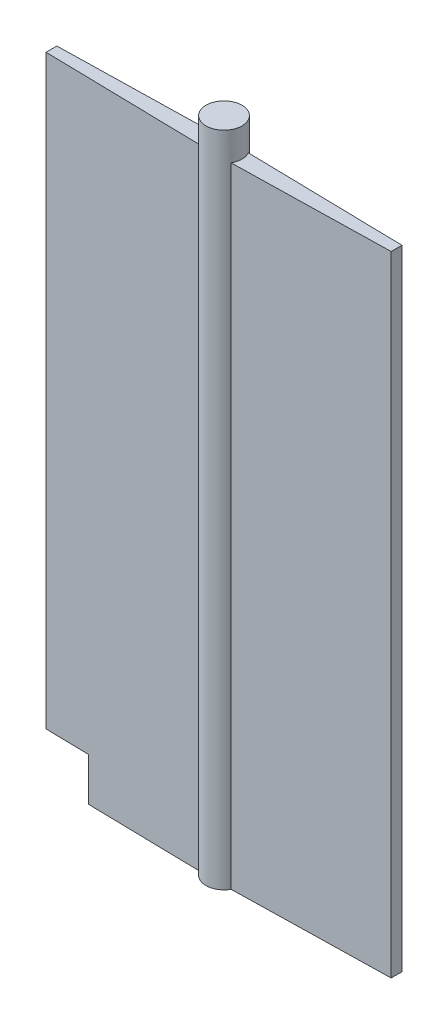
SolidWorks part; units mm, degrees
ref_plane "Front Plane" through (0, 0, 0) normal (0, 0, 1) x (1, 0, 0)
ref_plane "Top Plane" through (0, 0, 0) normal (0, 1, 0) x (1, 0, 0)
ref_plane "Right Plane" through (0, 0, 0) normal (1, 0, 0) x (0, 0, -1)
sketch "Sketch1" plane through (0, 0, 0) normal (0, 1, 0) x (1, 0, 0)
  line L0 (0, 3.175) -> (0, -3.175)
  line L3 (0, 3.175) -> (60.96, 1.905)
  line L4 (60.96, 1.905) -> (60.96, -1.905)
  line L5 (60.96, -1.905) -> (0, -3.175)
  line L6 (-60.96, -1.905) -> (0, -3.175)
  line L7 (-60.96, 1.905) -> (-60.96, -1.905)
  line L8 (0, 3.175) -> (-60.96, 1.905)
  circle A0 centre (0, 0) radius 6.35
  point P5 (60.96, 0)
  point P6 (0, 0)
  dimension "D1" = 12.7
  dimension "D2" = 6.35
  dimension "D3" = 3.81
  dimension "D4" = 60.96
extrude "Boss-Extrude1" add sketch "Sketch1" along normal blind 222.25 contours A0 L5 L4 L3 | A0 L8 L7 L6
sketch "Sketch2" plane through (0, 222.25, 0) normal (0, 1, 0) x (1, 0, 0)
  circle A0 centre (0, 0) radius 6.35
extrude "Boss-Extrude2" add sketch "Sketch2" along normal blind 10.16
sketch "Sketch3" plane through (0, 0, 0) normal (0, 0, 1) x (1, 0, 0)
  line L1 (-60.96, 0) -> (-45.72, 0)
  line L2 (-60.96, 0) -> (-60.96, 15.24)
  line L3 (-60.96, 15.24) -> (-45.72, 15.24)
  line L4 (-45.72, 0) -> (-45.72, 15.24)
  dimension "D1" = 15.24
  dimension "D2" = 15.24
extrude "Cut-Extrude1" cut sketch "Sketch3" against normal through all both and the other way through all
ref_plane "Plane1" through (0, 226.06, 0) normal (0, 1, 0) x (1, 0, 0)
sketch "Sketch4" plane through (0, 226.06, 0) normal (0, 1, 0) x (1, 0, 0)
  line L0 (5.3882, 5.3882) -> (-20.0118, 30.7882)
  line L2 (-30.7882, 20.0118) -> (-5.3882, -5.3882)
  arc A1 (-5.3882, -5.3882) -> (5.3882, 5.3882) centre (0, 0) ccw
  arc A2 (-20.0118, 30.7882) -> (-30.7882, 20.0118) centre (-25.4, 25.4) ccw
  circle A4 centre (0, 0) radius 6.35 construction
  circle A5 centre (0, 0) radius 6.35
  circle A6 centre (-25.4, 25.4) radius 1.5875
  dimension "D2" = 7.62
  dimension "D6" = 3.175
  dimension "D3" = 15.24
  dimension "D4" = 25.4
  dimension "D5" = 25.4
extrude "Boss-Extrude3" [suppressed] add sketch "Sketch4" along normal blind 3.175
